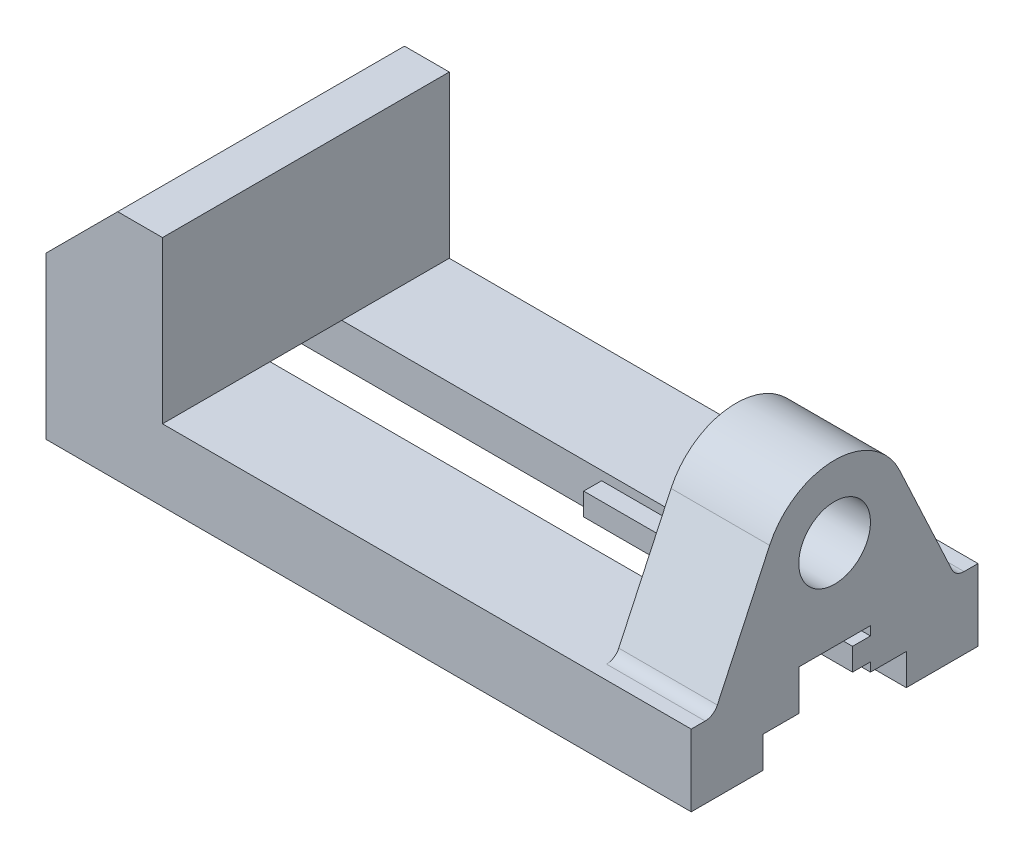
SolidWorks part; units mm, degrees
ref_plane "Front Plane" through (0, 0, 0) normal (0, 0, 1) x (1, 0, 0)
ref_plane "Top Plane" through (0, 0, 0) normal (0, 1, 0) x (1, 0, 0)
ref_plane "Right Plane" through (0, 0, 0) normal (1, 0, 0) x (0, 0, -1)
sketch "Sketch1" plane through (0, 0, 0) normal (0, 0, 1) x (1, 0, 0)
  line L0 (0, 36) -> (0, 0)
  line L1 (0, 0) -> (144, 0)
  line L2 (144, 0) -> (144, 16)
  line L3 (144, 16) -> (26, 16)
  line L4 (26, 16) -> (26, 52)
  line L5 (26, 52) -> (16, 52)
  line L6 (16, 52) -> (0, 36)
  dimension "D1" = 144
  dimension "D2" = 16
  dimension "D3" = 36
  dimension "D4" = 16
  dimension "D5" = 10
  dimension "D6" = 16
extrude "Boss-Extrude1" add sketch "Sketch1" along normal mid plane 64
sketch "Sketch2" plane through (144, 0, 0) normal (1, 0, 0) x (0, 0, -1)
  line L0 (-26.9802, 16) -> (-14.5009, 42.7619)
  line L1 (-32, 16) -> (32, 16) construction
  line L2 (26.9802, 16) -> (14.5009, 42.7619)
  line L4 (-32, 16) -> (32, 16) construction
  line L5 (-26.9802, 16) -> (26.9802, 16)
  line L6 (-32, 0) -> (32, 0) construction
  line L7 (0, 0) -> (0, 36) construction
  arc A0 (14.5009, 42.7619) -> (-14.5009, 42.7619) centre (0, 36) ccw
  circle A1 centre (0, 36) radius 8
  point P9 (0, 16)
  dimension "D1" = 16
  dimension "D4" = 16
  dimension "D2" = 36
  dimension "D3" = 50
extrude "Boss-Extrude2" add sketch "Sketch2" against normal blind 22
fillet "Fillet1" radius 3 2 edges at (133, 16, -26.9802) (133, 16, 26.9802)
sketch "Sketch3" plane through (144, 0, 0) normal (1, 0, 0) x (0, 0, -1)
  line L0 (0, 0) -> (0, 19.833) construction
  line L1 (-16, 0) -> (-16, 7)
  line L2 (-32, 0) -> (32, 0) construction
  line L3 (-16, 7) -> (-8, 7)
  line L4 (-8, 7) -> (-8, 16)
  line L5 (-8, 16) -> (8, 16)
  line L6 (8, 16) -> (8, 7)
  line L7 (8, 7) -> (16, 7)
  line L8 (16, 7) -> (16, 0)
  line L9 (16, 0) -> (-16, 0)
  dimension "D1" = 32
  dimension "D2" = 16
  dimension "D3" = 7
  dimension "D4" = 16
extrude "Cut-Extrude1" cut sketch "Sketch3" against normal through all
hole_wizard "M6x1.0 Tapped Hole1" positions "Sketch6" profile "Sketch5" tap size "M6x1.0" standard "ANSI Metric"
sketch "Sketch6" plane through (0, 0, 0) normal (0, -1, 0) x (1, 0, 0)
  line L0 (0, 0) -> (109.7104, 0) construction
  point P0 (106, -22)
  point P1 (36, -22)
  point P3 (36, 22)
  point P5 (106, 22)
  dimension "D1" = 38
  dimension "D2" = 70
  dimension "D3" = 44
sketch "Sketch5" plane through (106, 0, -22) normal (1, 0, 0) x (0, 0, -1)
  line L0 (0, 0) -> (0, 11.8026)
  line L1 (0, 11.8026) -> (3, 10)
  line L2 (3, 10) -> (3, 0)
  line L5 (3, 0) -> (0, 0)
  line L10 (0, 11.8026) -> (-3, 10) construction
  line L11 (0, -6.35) -> (0, 107.95) construction
  dimension "Tap Drill Dia." = 6
  dimension "Tap Drill Depth" = 10
  dimension "Drill Angle" = 118
sketch "Sketch7" plane through (144, 0, 0) normal (1, 0, 0) x (0, 0, -1)
  line L0 (8, 7) -> (8, 16) construction
  line L1 (4, 14) -> (8, 14)
  line L2 (4, 14) -> (4, 9)
  line L3 (4, 9) -> (8, 9)
  line L4 (8, 14) -> (8, 9)
  line L5 (16, 7) -> (8, 7) construction
  dimension "D1" = 4
  dimension "D2" = 5
  dimension "D3" = 2
extrude "Boss-Extrude3" add sketch "Sketch7" against normal blind 60
